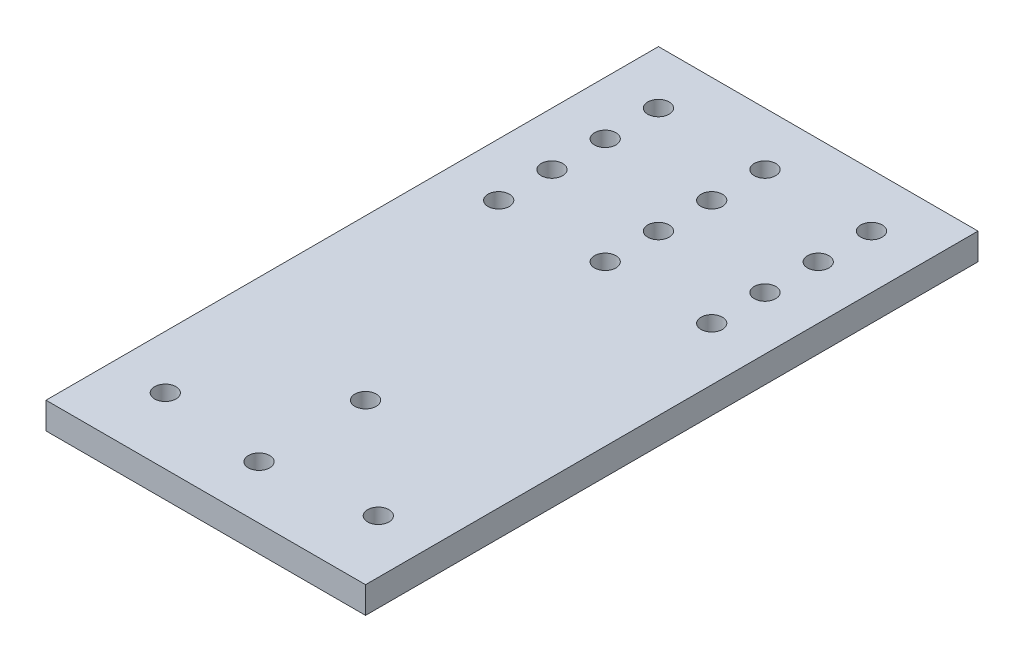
SolidWorks part; units mm, degrees
ref_plane "Front Plane" through (0, 0, 0) normal (0, 0, 1) x (1, 0, 0)
ref_plane "Top Plane" through (0, 0, 0) normal (0, 1, 0) x (1, 0, 0)
ref_plane "Right Plane" through (0, 0, 0) normal (1, 0, 0) x (0, 0, -1)
sketch "Sketch1" plane through (0, 0, 0) normal (0, 1, 0) x (1, 0, 0)
  line L1 (-38.1, -73.025) -> (38.1, -73.025)
  line L2 (-38.1, -73.025) -> (-38.1, 73.025)
  line L3 (-38.1, 73.025) -> (38.1, 73.025)
  line L4 (38.1, -73.025) -> (38.1, 73.025)
  line L5 (-38.1, -73.025) -> (38.1, 73.025) construction
  line L6 (-38.1, 73.025) -> (38.1, -73.025) construction
  point P0 (0, 0)
extrude "Boss-Extrude1" add sketch "Sketch1" along normal blind 6.35
hole_wizard "1/4-20 Tapped Hole1" positions "Sketch2" profile "Sketch3" tap size "1/4-20" standard "ANSI Inch"
sketch "Sketch2" plane through (0, 6.35, 0) normal (0, 1, 0) x (1, 0, 0)
  line L0 (-38.1, -73.025) -> (38.1, -73.025) construction
  line L1 (38.1, -73.025) -> (38.1, 73.025) construction
  line L2 (-38.1, 73.025) -> (-38.1, -73.025) construction
  point P0 (0, -60.325)
  point P2 (0, -34.925)
  point P4 (-25.4, -57.277)
  point P6 (25.4, -57.277)
  point P10 (0, 22.225)
  point P12 (0, 34.925)
  point P14 (0, 47.625)
  point P16 (0, 60.325)
  point P18 (-25.4, 60.325)
  point P20 (-25.4, 47.625)
  point P22 (-25.4, 34.925)
  point P24 (-25.4, 22.225)
  point P26 (25.4, 22.225)
  point P28 (25.4, 34.925)
  point P30 (25.4, 47.625)
  point P32 (25.4, 60.325)
  dimension "D1" = 12.7
  dimension "D2" = 50.8
  dimension "D3" = 12.7
  dimension "D4" = 15.748
  dimension "D5" = 12.7
  dimension "D6" = 12.7
  dimension "D7" = 12.7
  dimension "D8" = 12.7
  dimension "D9" = 12.7
  dimension "D10" = 12.7
  dimension "D11" = 12.7
  dimension "D12" = 12.7
  dimension "D13" = 12.7
  dimension "D14" = 25.4
  dimension "D15" = 25.4
  dimension "D16" = 38.1
  dimension "D17" = 95.25
  dimension "D18" = 25.4
sketch "Sketch3" plane through (0, 6.35, 60.325) normal (1, 0, 0) x (0, 0, 1)
  line L0 (0, 0) -> (0, 6.35)
  line L1 (0, 6.35) -> (2.5527, 6.35)
  line L2 (2.5527, 6.35) -> (2.5527, 0)
  line L5 (2.5527, 0) -> (0, 0)
  line L11 (0, -6.35) -> (0, 107.95) construction
  dimension "Thru Tap Drill Dia." = 5.1054
  dimension "Thru Tap Drill Depth" = 6.35
